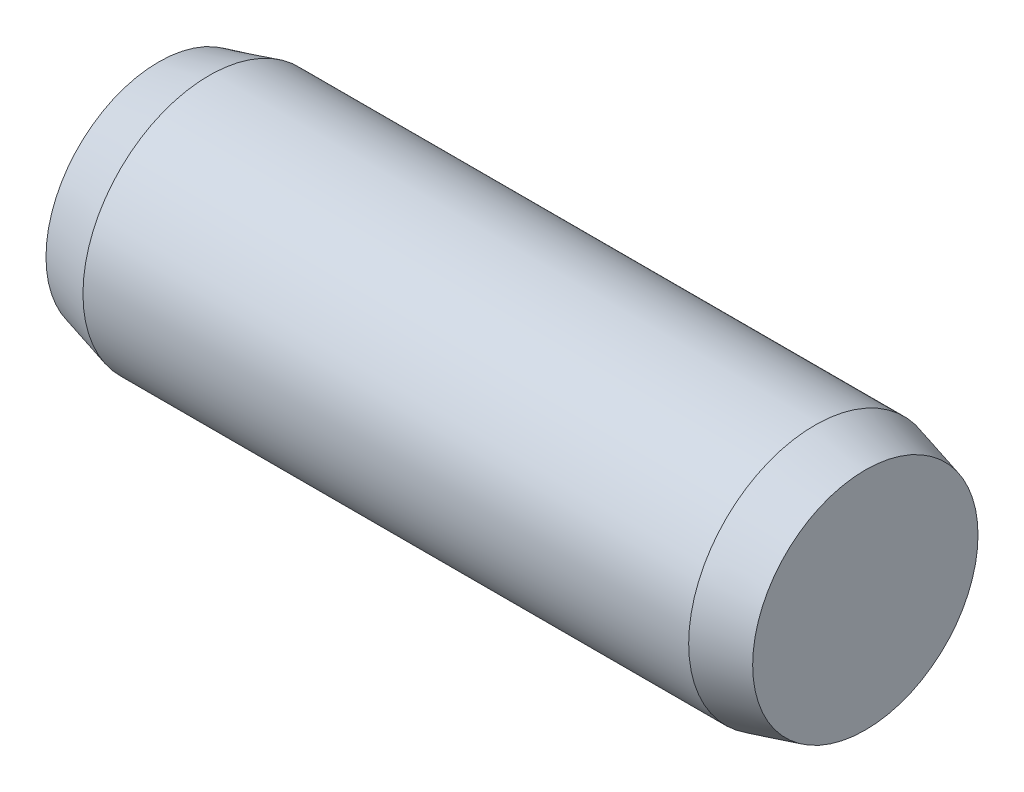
SolidWorks part; units mm, degrees
ref_plane "Plane1" through (0, 0, 0) normal (0, 0, 1) x (1, 0, 0)
ref_plane "Plane2" through (0, 0, 0) normal (0, 1, 0) x (1, 0, 0)
ref_plane "Plane3" through (0, 0, 0) normal (1, 0, 0) x (0, 0, -1)
sketch "Sketch1" plane through (0, 0, 0) normal (0, 0, 1) x (1, 0, 0)
  line L1 (-6.35, 0) -> (107.95, 0) construction
  line L2 (0, 0) -> (28, 0)
  line L3 (28, 0) -> (28, 4.4641)
  line L4 (28, 4.4641) -> (26, 5)
  line L5 (26, 5) -> (2, 5)
  line L6 (0, 4.4641) -> (0, 0)
  line L7 (0, 4.4641) -> (2, 5)
revolve "Base-Revolve" add sketch "Sketch1" angle 360 about L1
equation "\"D3@Sketch1\" = 15.0"
equation "\"D1@Sketch1\" = \"Chamfer_len@Sketch1\""
equation "\"D2@Sketch1\" = \"D3@Sketch1\""
